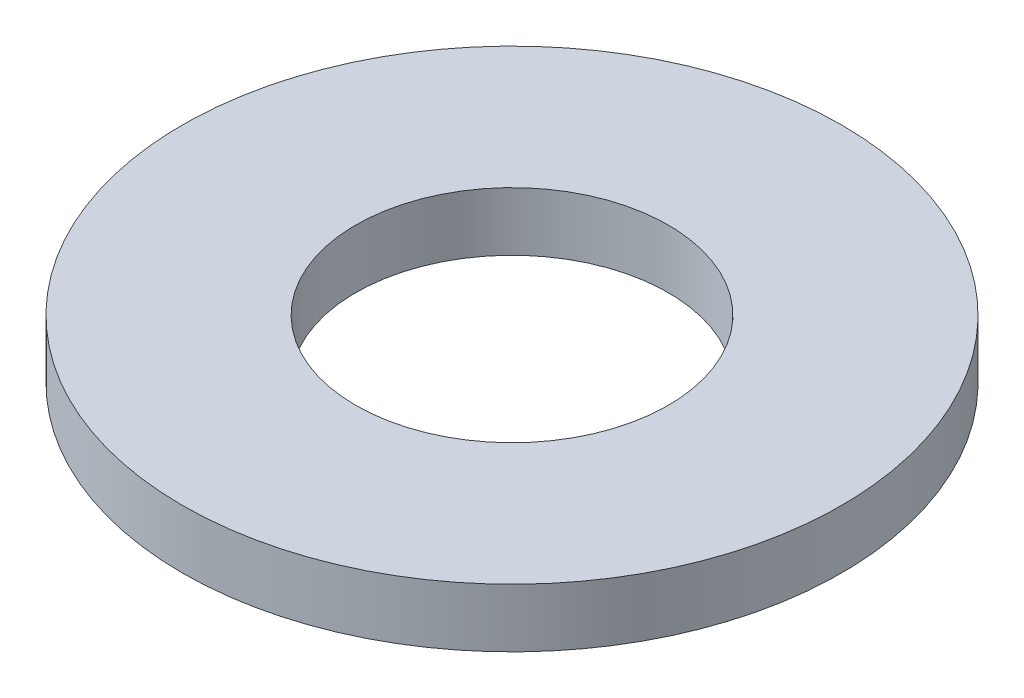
SolidWorks part; units mm, degrees
ref_plane "Front Plane" through (0, 0, 0) normal (0, 0, 1) x (1, 0, 0)
ref_plane "Top Plane" through (0, 0, 0) normal (0, 1, 0) x (1, 0, 0)
ref_plane "Right Plane" through (0, 0, 0) normal (1, 0, 0) x (0, 0, -1)
sketch "Sketch2" plane through (0, 0, 0) normal (0, 1, 0) x (1, 0, 0)
  circle A0 centre (0, 0) radius 20.32
  dimension "D1" = 40.64
sketch "Sketch3" plane through (0, 0, 0) normal (0, 1, 0) x (1, 0, 0)
  circle A0 centre (0, 0) radius 42.8625
  dimension "D1" = 85.725
extrude "Boss-Extrude1" add sketch "Sketch3" along normal blind 7.62
extrude "Cut-Extrude1" cut sketch "Sketch2" along normal blind 101.6
